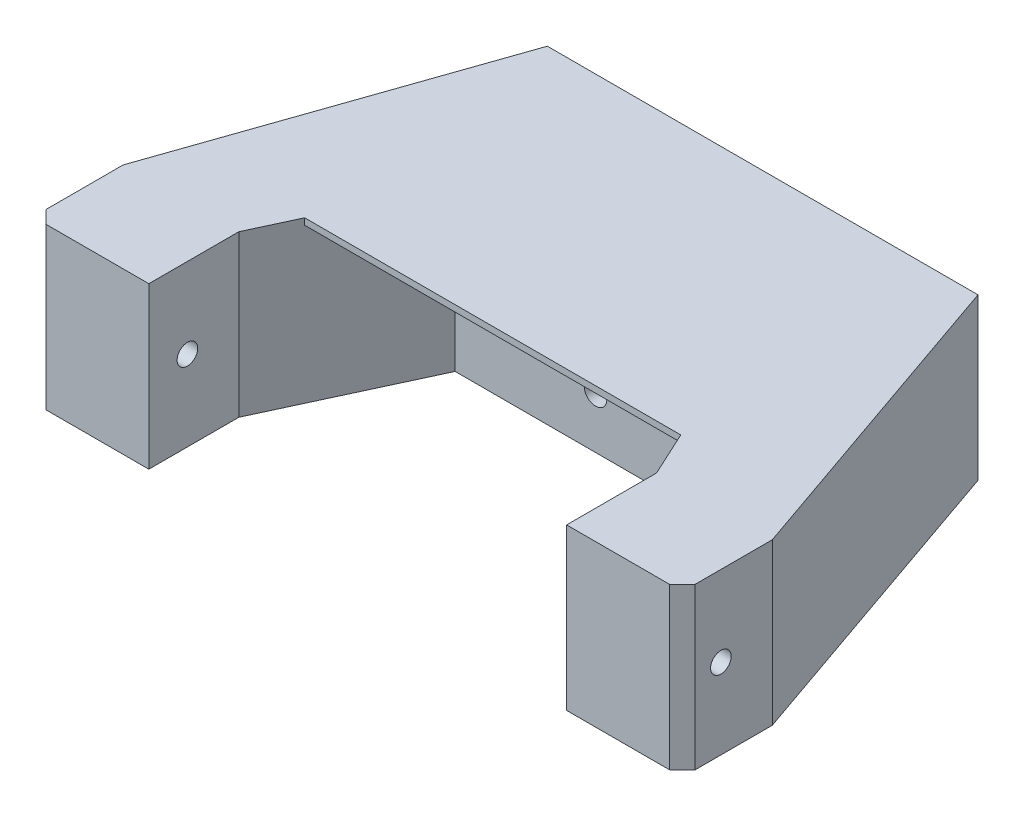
SolidWorks part; units mm, degrees
ref_plane "Спереди" through (0, 0, 0) normal (0, 0, 1) x (1, 0, 0)
ref_plane "Сверху" through (0, 0, 0) normal (0, 1, 0) x (1, 0, 0)
ref_plane "Справа" through (0, 0, 0) normal (1, 0, 0) x (0, 0, -1)
sketch "Эскиз1" plane through (0, 0, 0) normal (0, 1, 0) x (1, 0, 0)
  line L0 (0, 0) -> (0, 22) construction
  line L1 (-9.0151, 0) -> (9.0151, 0) construction
  line L2 (-33.5, 22) -> (33.5, 22)
  line L3 (33.5, 22) -> (50.5, -27)
  line L4 (50.5, -27) -> (32.5, -27)
  line L5 (32.5, -27) -> (20, 0)
  line L6 (20, 0) -> (0, 0)
  line L7 (20, 0) -> (33.5, 22) construction
  line L8 (-20, 0) -> (-33.5, 22) construction
  line L9 (-20, 0) -> (0, 0)
  line L10 (-32.5, -27) -> (-20, 0)
  line L11 (-50.5, -27) -> (-32.5, -27)
  line L12 (-33.5, 22) -> (-50.5, -27)
  circle A0 centre (25, 10) radius 8.05
  circle A1 centre (-25, 10) radius 8.05
  dimension "D1" = 16.1
  dimension "D5" = 50
  dimension "D2" = 22
  dimension "D3" = 101
  dimension "D4" = 18
  dimension "D6" = 20
  dimension "D7" = 10
  dimension "D8" = 67
  dimension "D9" = 27
extrude "Бобышка-Вытянуть1" add sketch "Эскиз1" along normal blind 25 contours L2 L12 L11 L10 L9 L6 L5 L4 L3 A0 A1
sketch "Эскиз10" plane through (0, 25, 0) normal (0, 1, 0) x (1, 0, 0)
  circle A0 centre (-25, 10) radius 8.05
  circle A1 centre (25, 10) radius 8.05
  circle A2 centre (-25, 10) radius 8.05 construction
  circle A3 centre (25, 10) radius 8.05 construction
extrude "Бобышка-Вытянуть3" add sketch "Эскиз10" against normal blind 1
sketch "Эскиз11" plane through (0, 25, 0) normal (0, 1, 0) x (1, 0, 0)
  line L0 (-20, 0) -> (-29.2593, -20)
  line L1 (-32.5, -27) -> (-20, 0) construction
  line L2 (-29.2593, -20) -> (29.2593, -20)
  line L3 (32.5, -27) -> (20, 0) construction
  line L4 (29.2593, -20) -> (20, 0)
  line L5 (20, 0) -> (-20, 0)
  dimension "D1" = 20
extrude "Бобышка-Вытянуть4" add sketch "Эскиз11" against normal blind 1
sketch "Эскиз12" plane through (0, 0, 27) normal (0, 0, 1) x (1, 0, 0)
  line L1 (-50.5, 25) -> (-32.5, 25)
  line L2 (-50.5, 25) -> (-50.5, 0)
  line L3 (-50.5, 0) -> (-32.5, 0)
  line L4 (-32.5, 25) -> (-32.5, 0)
  line L5 (32.5, 0) -> (50.5, 0)
  line L6 (32.5, 0) -> (32.5, 25)
  line L7 (32.5, 25) -> (50.5, 25)
  line L8 (50.5, 0) -> (50.5, 25)
extrude "Бобышка-Вытянуть5" add sketch "Эскиз12" along normal blind 14
sketch "Эскиз15" plane through (-50.5, 0, 0) normal (-1, 0, 0) x (0, 0, 1)
  line L0 (41, 12.5) -> (27, 12.5) construction
  line L1 (41, 25) -> (41, 0) construction
  line L2 (27, 25) -> (27, 0) construction
  circle A0 centre (35, 12.5) radius 1.6
  dimension "D1" = 3.2
  dimension "D2" = 6
extrude "Вырез-Вытянуть6" cut sketch "Эскиз15" against normal blind 231
sketch "Эскиз16" plane through (0, 0, 0) normal (0, -1, 0) x (1, 0, 0)
  line L0 (-21.8519, 4) -> (-20, 0)
  line L1 (-20, 0) -> (-29.2593, 20) construction
  line L2 (-20, 0) -> (20, 0)
  line L3 (20, 0) -> (21.8519, 4)
  line L4 (29.2593, 20) -> (20, 0) construction
  line L5 (21.8519, 4) -> (-21.8519, 4)
  dimension "D1" = 4
extrude "Бобышка-Вытянуть6" add sketch "Эскиз16" against normal up to surface (24 mm away)
sketch "Эскиз8" plane through (0, 0, -22) normal (0, 0, -1) x (-1, 0, 0)
  line L0 (0, 0) -> (0, 25) construction
  line L1 (33.5, 25) -> (-33.5, 25) construction
  line L2 (33.5, 0) -> (-33.5, 0) construction
  circle A0 centre (0, 8) radius 1.75
  dimension "D1" = 3.5
  dimension "D2" = 8
extrude "Вырез-Вытянуть2" cut sketch "Эскиз8" against normal blind 27
sketch "Эскиз9" plane through (0, 0, -22) normal (0, 0, -1) x (-1, 0, 0)
  circle A0 centre (0, 8) radius 3.5
  dimension "D1" = 7
extrude "Вырез-Вытянуть3" cut sketch "Эскиз9" against normal blind 12
sketch "Эскиз17" plane through (0, 25, 0) normal (0, 1, 0) x (1, 0, 0)
  line L0 (-50.5, -39) -> (-48.5, -41)
  line L1 (-50.5, -41) -> (-50.5, -27) construction
  line L2 (-32.5, -41) -> (-50.5, -41) construction
  line L3 (-48.5, -41) -> (-50.5, -41)
  line L4 (-50.5, -39) -> (-50.5, -41)
  line L5 (0, 0) -> (0, -44.4396) construction
  line L6 (50.5, -39) -> (50.5, -41)
  line L7 (48.5, -41) -> (50.5, -41)
  line L8 (50.5, -39) -> (48.5, -41)
  dimension "D1" = 2
extrude "Вырез-Вытянуть7" cut sketch "Эскиз17" against normal blind 85
